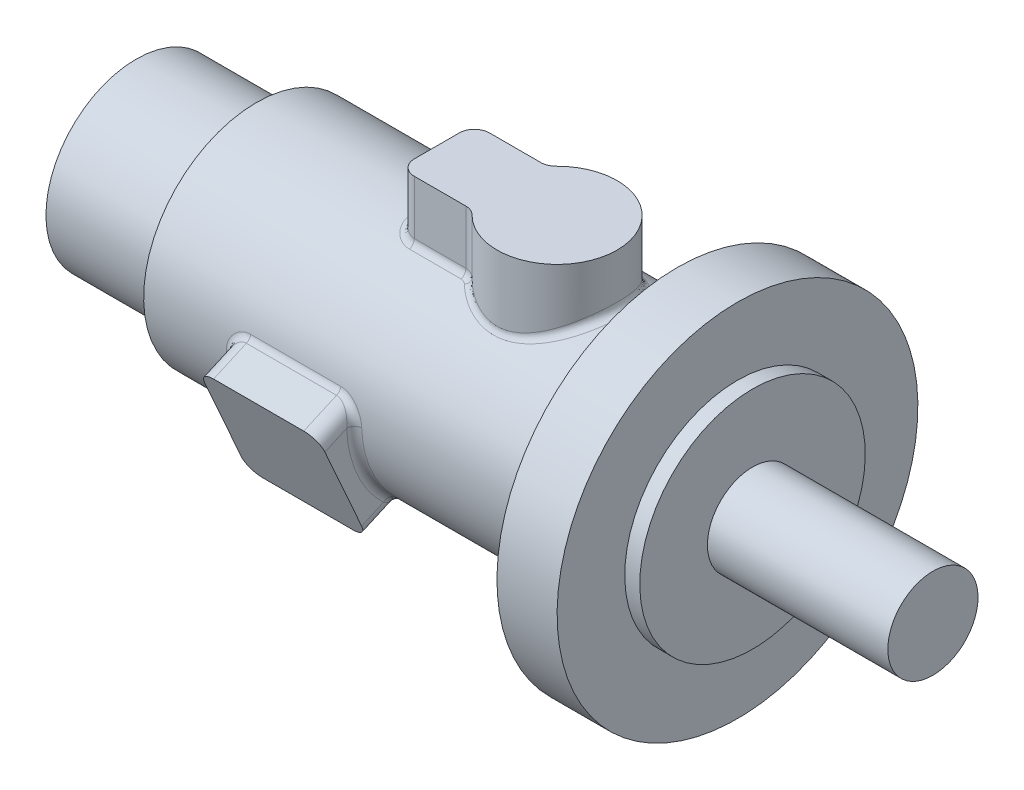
SolidWorks part; units mm, degrees
ref_plane "Front" through (0, 0, 0) normal (0, 0, 1) x (1, 0, 0)
ref_plane "Top" through (0, 0, 0) normal (0, 1, 0) x (1, 0, 0)
ref_plane "Right" through (0, 0, 0) normal (1, 0, 0) x (0, 0, -1)
sketch "Sketch1" plane through (0, 0, 0) normal (0, 0, 1) x (1, 0, 0)
  line L0 (42.975, 0) -> (28.575, 0) construction
  line L1 (0, 0) -> (0, 23.8125)
  line L2 (0, 23.8125) -> (-3.175, 23.8125)
  line L3 (-3.175, 23.8125) -> (-3.175, 38.1)
  line L4 (-3.175, 38.1) -> (-15.875, 38.1)
  line L5 (-15.875, 38.1) -> (-15.875, 23.8125)
  line L6 (-15.875, 23.8125) -> (-104.775, 23.8125)
  line L7 (-104.775, 23.8125) -> (-104.775, 19.05)
  line L8 (-104.775, 19.05) -> (-130.175, 19.05)
  line L9 (-130.175, 19.05) -> (-130.175, 0)
  line L10 (-130.175, 0) -> (0, 0)
  line L14 (0, 0) -> (-120.4051, 0) construction
  dimension "D1" = 47.625
  dimension "D2" = 3.175
  dimension "D3" = 12.7
  dimension "D4" = 76.2
  dimension "D5" = 127
  dimension "D6" = 25.4
  dimension "D7" = 38.1
revolve "case" add sketch "Sketch1" angle 360 about L0
sketch "Sketch2" plane through (0, 0, 0) normal (0, 1, 0) x (1, 0, 0)
  line L0 (0, 0) -> (-124.2367, 0) construction
  line L1 (-3.175, -38.1) -> (-3.175, 38.1) construction
  line L2 (-66.675, 7.9375) -> (-51.1889, 7.9375)
  line L3 (-66.675, -7.9375) -> (-51.1889, -7.9375)
  line L4 (-66.675, 7.9375) -> (-66.675, -7.9375)
  arc A1 (-51.1889, -7.9375) -> (-51.1889, 7.9375) centre (-41.275, 0) ccw
  dimension "D2" = 12.7
  dimension "D3" = 25.4
  dimension "D1" = 38.1
  dimension "D4" = 7.9375
extrude "upper" add sketch "Sketch2" along normal blind 34.925
ref_plane "angle front" through (0, 0, 0) normal (0, -0.4067, 0.9135) x (1, 0, 0)
sketch "Sketch3" plane through (0, 0, 0) normal (0, -0.4067, 0.9135) x (1, 0, 0)
  line L1 (-85.725, -12.7) -> (-60.325, -12.7)
  line L2 (-85.725, -12.7) -> (-85.725, 12.7)
  line L3 (-85.725, 12.7) -> (-60.325, 12.7)
  line L4 (-60.325, -12.7) -> (-60.325, 12.7)
  line L6 (-15.875, 38.1) -> (-15.875, -38.1) construction
  line L7 (-85.725, 0) -> (-60.325, 0) construction
  line L8 (42.975, 0) -> (28.575, 0) construction
  dimension "D1" = 44.45
  dimension "D2" = 25.4
  dimension "D3" = 25.4
extrude "side" add sketch "Sketch3" along normal blind 28.575
fillet "Fillet1" radius 3.175 8 edges at (-66.675, 28.6878, -7.9375) (-51.1889, 28.6878, -7.9375) (-51.1889, 28.6878, 7.9375) (-66.675, 28.6878, 7.9375) (-60.325, 1.6943, 27.4187) (-85.725, 1.6943, 27.4187) (-85.725, -21.5097, 17.0876) (-60.325, -21.5097, 17.0876)
fillet "Fillet2" radius 1.5875 16 edges at (-84.3216, -19.4359, 13.7579) (-73.025, -19.795, 13.2361) (-61.1589, -19.1035, 14.2159) (-60.325, -9.6854, 21.7538) (-85.725, -9.6854, 21.7538) (-61.7284, 2.7811, 23.6495) (-84.8911, 2.2182, 23.709) (-66.675, 23.8125, 0) (-65.9498, 22.8262, -6.7821) (-58.056, 22.4506, -7.9375) (-51.6109, 22.3927, -8.0995) (-28.7569, 23.716, -2.1418) (-65.4072, 22.6657, 7.3009) (-58.056, 22.4506, 7.9375) (-51.1647, 22.3241, 8.2866) (-73.025, 3.4091, 23.5672)
sketch "Sketch4" plane through (0, 0, 0) normal (1, 0, 0) x (0, 0, -1)
  circle A0 centre (0, 0) radius 9.525
  dimension "D1" = 19.05
extrude "shaft" add sketch "Sketch4" along normal blind 38.1
